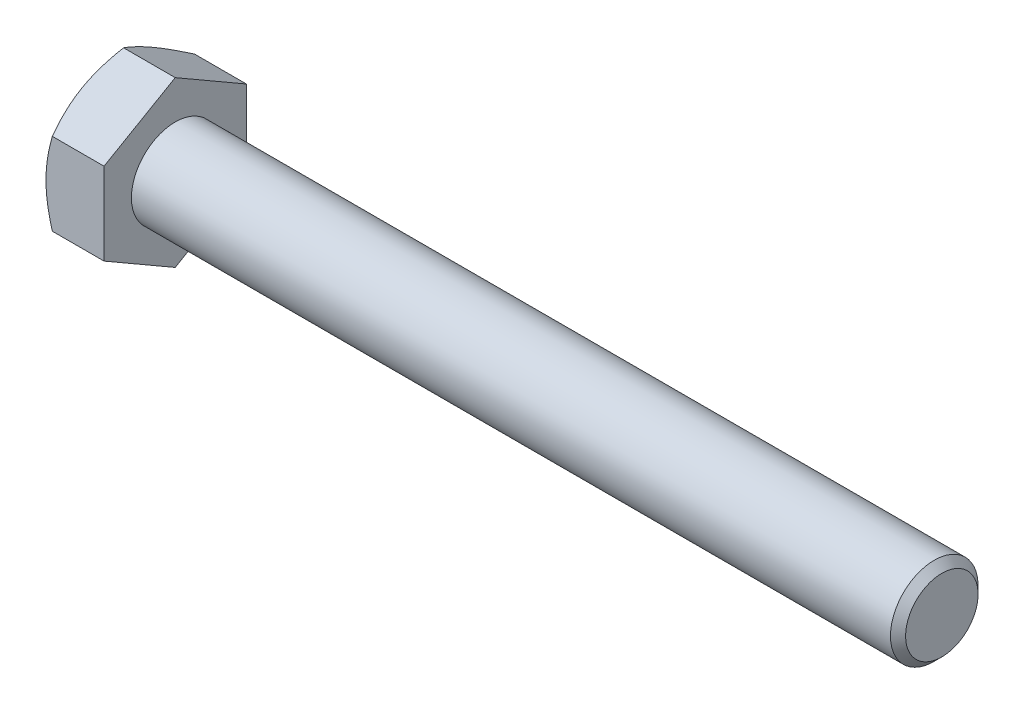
SolidWorks part; units mm, degrees
ref_plane "Plane1" through (0, 0, 0) normal (0, 0, 1) x (1, 0, 0)
ref_plane "Plane2" through (0, 0, 0) normal (0, 1, 0) x (1, 0, 0)
ref_plane "Plane3" through (0, 0, 0) normal (1, 0, 0) x (0, 0, -1)
sketch "Sketch1" plane through (0, 0, 0) normal (1, 0, 0) x (0, 0, -1)
  line L0 (6.5, 3.7528) -> (6.5, -3.7528)
  line L1 (-6.5, 3.7528) -> (-6.5, -3.7528)
  line L2 (6.5, -3.7528) -> (0, -7.5056)
  line L3 (0, -7.5056) -> (-6.5, -3.7528)
  line L4 (6.5, 3.7528) -> (0, 7.5056)
  line L5 (0, 7.5056) -> (-6.5, 3.7528)
  dimension "Width_flats" = 13
  dimension "D2" = 120
  dimension "D3" = 6.5
  dimension "D4" = 6.5
  dimension "D5" = 6.5
extrude "BaseHead" add sketch "Sketch1" along normal blind 5.3
sketch "BodySke" plane through (0, 0, 0) normal (0, 0, 1) x (1, 0, 0)
  line L1 (0, 0) -> (75.3, 0)
  line L2 (0, 0) -> (0, 4)
  line L4 (75.3, 0) -> (75.3, 3.3095)
  line L5 (5.3, 7.5056) -> (5.3, 3.7528) construction
  line L6 (75.3, 3.3095) -> (74.6095, 4)
  line L7 (0, 0) -> (110.49, 0) construction
  line L8 (75.3, -3.3095) -> (74.6095, -4) construction
  line L9 (0, 3.7528) -> (0, -3.7528) construction
  line L10 (6.55, 15.24) -> (6.55, -1.27) construction
  line L11 (5.3, 15.24) -> (5.3, -1.27) construction
  line L12 (5.3, 3.7528) -> (5.3, -3.7528) construction
  line L15 (0, 4) -> (74.6095, 4)
  dimension "Length" = 70
  dimension "Body_ch_ang" = 45
  dimension "Diameter" = 8
  dimension "Minor_dia" = 6.619
  dimension "Advance" = 1.25
  dimension "Thread_nom" = 70
revolve "BaseBody" add sketch "BodySke" angle 360 about L7
fillet "HeadFillet" [suppressed] radius 0.4
sketch "Sketch3" plane through (0, 0, 0) normal (0, 0, 1) x (1, 0, 0)
  line L0 (0, 6.5) -> (3.4673, 12.5056)
  line L1 (0, 7.5056) -> (0, 3.7528) construction
  line L2 (3.4673, 12.5056) -> (3.4673, 17.5056)
  line L3 (3.4673, 17.5056) -> (-10, 17.5056)
  line L4 (-10, 17.5056) -> (-10, 6.5)
  line L5 (-10, 6.5) -> (0, 6.5)
  line L6 (0, 0) -> (99.06, 0) construction
  line L7 (5.3, 7.5056) -> (0, 7.5056) construction
  dimension "D1" = 6.5
  dimension "D2" = 5
  dimension "D3" = 10
  dimension "D4" = 5
  dimension "Head_ch_ang" = 30
revolve "HeadChamfer" cut sketch "Sketch3" angle 360 about L6
sketch "ThdSchSke" plane through (0, 0, 0) normal (0, 0, 1) x (1, 0, 0)
  line L0 (6.55, -3.3095) -> (6.0665, -4)
  line L1 (6.55, -3.3095) -> (7.0335, -4)
  line L2 (7.0335, -4) -> (7.0335, -5)
  line L3 (-3.175, 0) -> (5.1513, 0) construction
  line L5 (7.0335, -5) -> (6.0665, -5)
  line L6 (6.0665, -5) -> (6.0665, -4)
  dimension "Thread_minor" = 6.619
  dimension "Diameter" = 8
  dimension "Start" = 6.55
  dimension "SideAngle" = 55
  dimension "VeeAngle" = 70
  dimension "Overcut" = 10
revolve "ThreadSchematic" [suppressed] cut sketch "ThdSchSke" angle 360 about L3
pattern_linear "ThdSchPat" [suppressed]
equation "\"D3@Sketch1\" = \"Width_flats@Sketch1\" / 2"
equation "\"D4@Sketch1\" = \"D3@Sketch1\""
equation "\"D5@Sketch1\" = \"D4@Sketch1\""
equation "\"Thread_minor@ThreadCosmetic\" = \"Minor_dia@BodySke\""
equation "\"D1@Sketch3\" = \"Width_flats@Sketch1\" / 2"
equation "\"Thread_length@ThreadCosmetic\" = ((sgn( (\"Length@BodySke\" - \"Advance@BodySke\" ) - \"Thread_nom@BodySke\" )-1)*( (\"Length@BodySke\" - \"Advance@BodySke\" ) - \"Thread_nom@BodySke\" ))/-2+ \"Thread_nom@BodySke\""
equation "\"Thread_minor@ThdSchSke\" = \"Minor_dia@BodySke\""
equation "\"Diameter@ThdSchSke\" = \"Diameter@BodySke\""
equation "\"Overcut@ThdSchSke\" = \"Diameter@BodySke\" * 1.25"
equation "\"Start@ThdSchSke\" = \"Head_ht@BaseHead\" + \"Length@BodySke\" - \"Thread_length@ThreadCosmetic\"  '---Non-countersunk---"
equation "\"Num_threads@ThdSchPat\" = int( \"Thread_length@ThreadCosmetic\" / \"Advance@BodySke\" + 0.999 )  + 1"
equation "\"Advance@ThdSchPat\" = \"Thread_length@ThreadCosmetic\" /  (\"Num_threads@ThdSchPat\" - 1) 'relax it"
equation "\"Num_threads@ThdSchPat\" = \"Num_threads@ThdSchPat\" - sgn( \"Num_threads@ThdSchPat\" - 1) '---chamfered tips only---"
